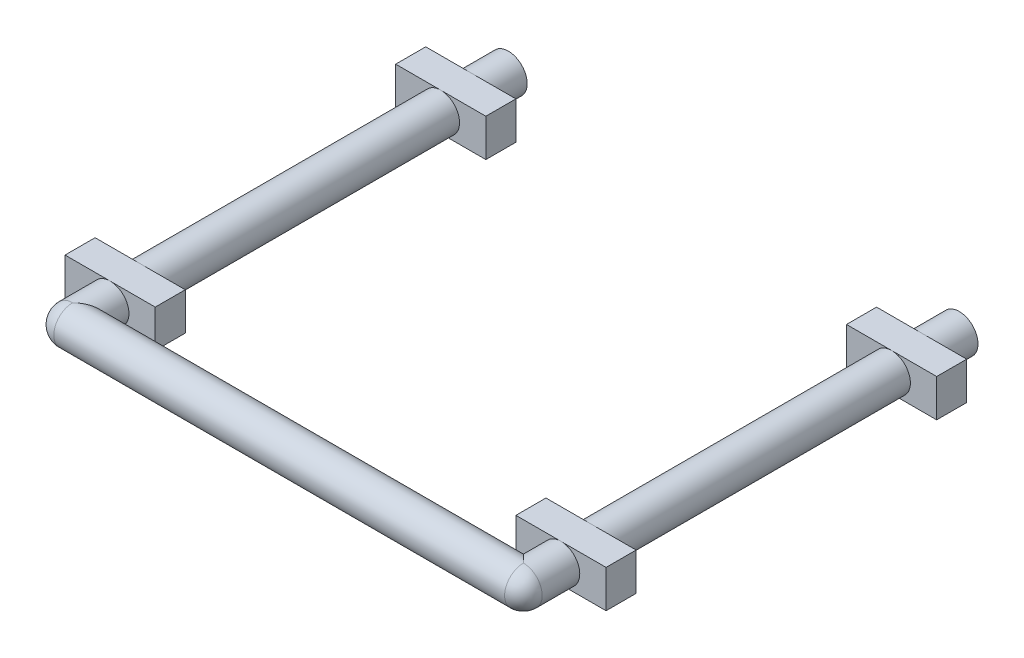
SolidWorks part; units mm, degrees
ref_plane "Face" through (0, 0, 0) normal (0, 0, 1) x (1, 0, 0)
ref_plane "Dessus" through (0, 0, 0) normal (0, 1, 0) x (1, 0, 0)
ref_plane "Droite" through (0, 0, 0) normal (1, 0, 0) x (0, 0, -1)
sketch "Esquisse1" plane through (0, 0, 0) normal (0, 0, 1) x (1, 0, 0)
  circle A0 centre (0, 0) radius 2.5
  dimension "D1" = 5
extrude "Base-Extrusion" add sketch "Esquisse1" along normal blind 5
sketch "Esquisse2" plane through (0, 0, 5) normal (0, 0, 1) x (1, 0, 0)
  line L1 (-6, 2.5) -> (6, 2.5)
  line L2 (-6, 2.5) -> (-6, -2.5)
  line L3 (-6, -2.5) -> (6, -2.5)
  line L4 (6, 2.5) -> (6, -2.5)
  circle A0 centre (0, 0) radius 2.5 construction
  dimension "D1" = 6
  dimension "D2" = 6
extrude "Boss.-Extru.1" add sketch "Esquisse2" along normal blind 4
sketch "Esquisse3" plane through (0, 0, 9) normal (0, 0, 1) x (1, 0, 0)
  arc A0 (0, 2.5) -> (0, -2.5) centre (0, 0) ccw construction
  arc A1 (0, 2.5) -> (0, -2.5) centre (0, 0) ccw
  arc A2 (0, -2.5) -> (0, 2.5) centre (0, 0) ccw construction
  arc A3 (0, -2.5) -> (0, 2.5) centre (0, 0) ccw
extrude "Boss.-Extru.2" add sketch "Esquisse3" along normal blind 40
sketch "Esquisse4" plane through (0, 0, 49) normal (0, 0, 1) x (1, 0, 0)
  line L1 (-6, 2.5) -> (6, 2.5)
  line L2 (-6, 2.5) -> (-6, -2.5)
  line L3 (-6, -2.5) -> (6, -2.5)
  line L4 (6, 2.5) -> (6, -2.5)
extrude "Boss.-Extru.3" add sketch "Esquisse4" along normal blind 4
sketch "Esquisse5" plane through (0, 0, 53) normal (0, 0, 1) x (1, 0, 0)
  arc A0 (0, -2.5) -> (0, 2.5) centre (0, 0) ccw construction
  arc A1 (0, -2.5) -> (0, 2.5) centre (0, 0) ccw
  arc A2 (0, 2.5) -> (0, -2.5) centre (0, 0) ccw construction
  arc A3 (0, 2.5) -> (0, -2.5) centre (0, 0) ccw
extrude "Boss.-Extru.4" add sketch "Esquisse5" along normal blind 5
sketch "Esquisse6" plane through (0, 0, 0) normal (1, 0, 0) x (0, 0, -1)
  line L0 (-5, 0) -> (0, 0) construction
  line L1 (-58, 2.5) -> (-58, -2.5) construction
  circle A0 centre (-58, 0) radius 2.5
  dimension "D1" = 5
extrude "Boss.-Extru.5" add sketch "Esquisse6" against normal blind 30
sketch "Esquisse7" plane through (0, 0, 58) normal (0, 0, 1) x (1, 0, 0)
  line L0 (0, 5.4262) -> (0, -5.1651) construction
  line L1 (0, 2.5) -> (0, -2.5)
  line L2 (0, 2.5) -> (0, -2.5)
  arc A1 (0, -2.5) -> (0, 2.5) centre (0, 0) ccw
  arc A2 (0, -2.5) -> (0, 2.5) centre (0, 0) ccw
  dimension "D1" = 0
revolve "Boss.-Révol.1" add sketch "Esquisse7" angle 360 about L0
ref_plane "Plan1" through (-30, 0, 0) normal (1, 0, 0) x (0, 0, -1)
mirror "Symétrie5" about plane through (-30, 0, 0) normal (1, 0, 0) of "Boss.-Révol.1", "Base-Extrusion", "Boss.-Extru.1", "Boss.-Extru.2", "Boss.-Extru.3", "Boss.-Extru.4", "Boss.-Extru.5"
mirror "Symétrie6" about plane through (-30, 0, 0) normal (1, 0, 0) of "Boss.-Extru.4"
mirror "Symétrie7" about plane through (-30, 0, 0) normal (1, 0, 0) of "Base-Extrusion", "Boss.-Extru.1", "Boss.-Extru.2", "Boss.-Extru.3"
mirror "Symétrie8" about plane through (-30, 0, 0) normal (1, 0, 0) of "Boss.-Extru.2"
mirror "Symétrie9" about plane through (-30, 0, 0) normal (1, 0, 0) of "Boss.-Extru.1"
mirror "Symétrie10" about plane through (-30, 0, 0) normal (1, 0, 0) of "Base-Extrusion"
